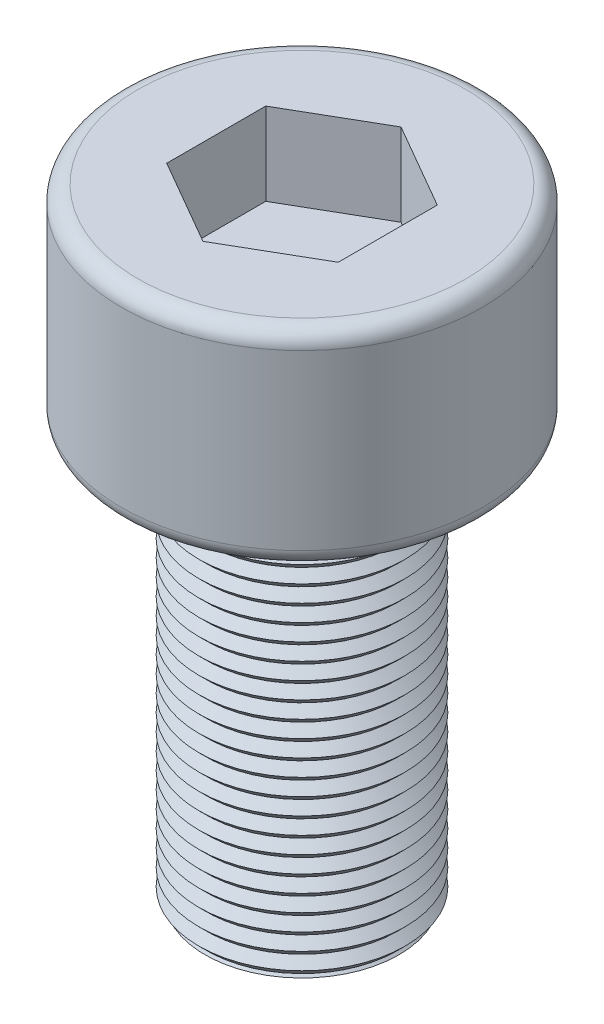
SolidWorks part; units mm, degrees
ref_plane "Front Plane" through (0, 0, 0) normal (0, 0, 1) x (1, 0, 0)
ref_plane "Top Plane" through (0, 0, 0) normal (0, 1, 0) x (1, 0, 0)
ref_plane "Right Plane" through (0, 0, 0) normal (1, 0, 0) x (0, 0, -1)
sketch "Sketch1" plane through (0, 0, 0) normal (0, 0, 1) x (1, 0, 0)
  line L0 (-1.4586, 6.35) -> (-1.5875, 6.35)
  line L1 (-2.7781, 6.35) -> (-2.7781, 9.525)
  line L2 (-2.7781, 9.525) -> (0, 9.525)
  line L3 (-1.4586, 6.35) -> (-1.5875, 6.35)
  line L4 (-1.5747, -3.175) -> (0, -3.175)
  line L5 (0, 0) -> (0, -3.175)
  line L6 (-1.5875, 0.1633) -> (-1.4586, 0.2922)
  line L7 (-1.4586, 0.2922) -> (-1.5875, 0.4211)
  line L8 (-1.5875, 0.4211) -> (-1.4586, 0.55)
  line L9 (-1.4586, 0.55) -> (-1.5875, 0.6789)
  line L10 (-1.5875, 0.6789) -> (-1.4586, 0.8078)
  line L11 (-1.4586, 0.8078) -> (-1.5875, 0.9367)
  line L12 (-1.5875, 0.9367) -> (-1.4586, 1.0655)
  line L13 (-1.4586, 1.0655) -> (-1.5875, 1.1944)
  line L14 (-1.5875, 1.1944) -> (-1.4586, 1.3233)
  line L15 (-1.4586, 1.3233) -> (-1.5875, 1.4522)
  line L16 (-1.5875, 1.4522) -> (-1.4586, 1.5811)
  line L17 (-1.4586, 1.5811) -> (-1.5875, 1.71)
  line L18 (-1.5875, 1.71) -> (-1.4586, 1.8389)
  line L19 (-1.4586, 1.8389) -> (-1.5875, 1.9678)
  line L20 (-1.5875, 1.9678) -> (-1.4586, 2.0967)
  line L21 (-1.4586, 2.0967) -> (-1.5875, 2.2255)
  line L22 (-1.5875, 2.2255) -> (-1.4586, 2.3544)
  line L23 (-1.4586, 2.3544) -> (-1.5875, 2.4833)
  line L24 (-1.5875, 2.4833) -> (-1.4586, 2.6122)
  line L25 (-1.4586, 2.6122) -> (-1.5875, 2.7411)
  line L26 (-1.5875, 2.7411) -> (-1.4586, 2.87)
  line L27 (-1.4586, 2.87) -> (-1.5875, 2.9989)
  line L28 (-1.5875, 2.9989) -> (-1.4586, 3.1278)
  line L29 (-1.4586, 3.1278) -> (-1.5875, 3.2567)
  line L30 (-1.5875, 3.2567) -> (-1.4586, 3.3855)
  line L31 (-1.4586, 3.3855) -> (-1.5875, 3.5144)
  line L32 (-1.5875, 3.5144) -> (-1.4586, 3.6433)
  line L33 (-1.4586, 3.6433) -> (-1.5875, 3.7722)
  line L34 (-1.5875, 3.7722) -> (-1.4586, 3.9011)
  line L35 (-1.4586, 3.9011) -> (-1.5875, 4.03)
  line L36 (-1.5875, 4.03) -> (-1.4586, 4.1589)
  line L37 (-1.4586, 4.1589) -> (-1.5875, 4.2878)
  line L38 (-1.5875, 4.2878) -> (-1.4586, 4.4167)
  line L39 (-1.4586, 4.4167) -> (-1.5875, 4.5455)
  line L40 (-1.5875, 4.5455) -> (-1.4586, 4.6744)
  line L41 (-1.4586, 4.6744) -> (-1.5875, 4.8033)
  line L42 (-1.5875, 4.8033) -> (-1.4586, 4.9322)
  line L43 (-1.4586, 4.9322) -> (-1.5875, 5.0611)
  line L44 (-1.5875, 5.0611) -> (-1.4586, 5.19)
  line L45 (-1.4586, 5.19) -> (-1.5875, 5.3189)
  line L46 (-1.5875, 5.3189) -> (-1.4586, 5.4478)
  line L47 (-1.4586, 5.4478) -> (-1.5875, 5.5767)
  line L48 (-1.5875, 5.5767) -> (-1.4586, 5.7055)
  line L49 (-1.5875, 6.0922) -> (-1.4586, 6.2211)
  line L50 (-1.4586, 6.2211) -> (-1.4586, 6.35)
  line L51 (-2.7781, 9.525) -> (0, 9.525)
  line L52 (-1.4586, 5.7055) -> (-1.5875, 5.8344)
  line L53 (-1.5875, 5.8344) -> (-1.4586, 5.9633)
  line L54 (-1.4586, 5.9633) -> (-1.5875, 6.0922)
  line L55 (-1.5875, 6.0922) -> (-1.4586, 6.2211)
  line L57 (0, 9.525) -> (0, 0)
  line L58 (-1.4586, 6.35) -> (-1.5875, 6.35)
  line L59 (-2.7781, 6.35) -> (-2.7781, 9.525)
  line L60 (-2.7781, 9.525) -> (0, 9.525)
  line L61 (-1.4586, 6.35) -> (-1.5875, 6.35)
  line L63 (-1.4586, 0.0344) -> (-1.5875, 0.1633)
  line L64 (-1.5875, 0.1633) -> (-1.4586, 0.2922)
  line L65 (-1.4586, 0.2922) -> (-1.5875, 0.4211)
  line L66 (-1.5875, 0.4211) -> (-1.4586, 0.55)
  line L67 (-1.4586, 0.55) -> (-1.5875, 0.6789)
  line L68 (-1.5875, 0.6789) -> (-1.4586, 0.8078)
  line L69 (-1.4586, 0.8078) -> (-1.5875, 0.9367)
  line L70 (-1.5875, 0.9367) -> (-1.4586, 1.0655)
  line L71 (-1.4586, 1.0655) -> (-1.5875, 1.1944)
  line L72 (-1.5875, 1.1944) -> (-1.4586, 1.3233)
  line L73 (-1.4586, 1.3233) -> (-1.5875, 1.4522)
  line L74 (-1.5875, 1.4522) -> (-1.4586, 1.5811)
  line L75 (-1.4586, 1.5811) -> (-1.5875, 1.71)
  line L76 (-1.5875, 1.71) -> (-1.4586, 1.8389)
  line L77 (-1.4586, 1.8389) -> (-1.5875, 1.9678)
  line L78 (-1.5875, 1.9678) -> (-1.4586, 2.0967)
  line L79 (-1.4586, 2.0967) -> (-1.5875, 2.2255)
  line L80 (-1.5875, 2.2255) -> (-1.4586, 2.3544)
  line L81 (-1.4586, 2.3544) -> (-1.5875, 2.4833)
  line L82 (-1.5875, 2.4833) -> (-1.4586, 2.6122)
  line L83 (-1.4586, 2.6122) -> (-1.5875, 2.7411)
  line L84 (-1.5875, 2.7411) -> (-1.4586, 2.87)
  line L85 (-1.4586, 2.87) -> (-1.5875, 2.9989)
  line L86 (-1.5875, 2.9989) -> (-1.4586, 3.1278)
  line L87 (-1.4586, 3.1278) -> (-1.5875, 3.2567)
  line L88 (-1.5875, 3.2567) -> (-1.4586, 3.3855)
  line L89 (-1.4586, 3.3855) -> (-1.5875, 3.5144)
  line L90 (-1.5875, 3.5144) -> (-1.4586, 3.6433)
  line L91 (-1.4586, 3.6433) -> (-1.5875, 3.7722)
  line L92 (-1.5875, 3.7722) -> (-1.4586, 3.9011)
  line L93 (-1.4586, 3.9011) -> (-1.5875, 4.03)
  line L94 (-1.5875, 4.03) -> (-1.4586, 4.1589)
  line L95 (-1.4586, 4.1589) -> (-1.5875, 4.2878)
  line L96 (-1.5875, 4.2878) -> (-1.4586, 4.4167)
  line L97 (-1.4586, 4.4167) -> (-1.5875, 4.5455)
  line L98 (-1.5875, 4.5455) -> (-1.4586, 4.6744)
  line L99 (-1.4586, 4.6744) -> (-1.5875, 4.8033)
  line L100 (-1.5875, 4.8033) -> (-1.4586, 4.9322)
  line L101 (-1.4586, 4.9322) -> (-1.5875, 5.0611)
  line L102 (-1.5875, 5.0611) -> (-1.4586, 5.19)
  line L103 (-1.4586, 5.19) -> (-1.5875, 5.3189)
  line L104 (-1.5875, 5.3189) -> (-1.4586, 5.4478)
  line L105 (-1.4586, 5.4478) -> (-1.5875, 5.5767)
  line L106 (-1.5875, 5.5767) -> (-1.4586, 5.7055)
  line L107 (-1.5875, 6.0922) -> (-1.4586, 6.2211)
  line L108 (-1.4586, 6.2211) -> (-1.4586, 6.35)
  line L109 (-2.7781, 9.525) -> (0, 9.525)
  line L110 (-1.4586, 5.7055) -> (-1.5875, 5.8344)
  line L111 (-1.5875, 5.8344) -> (-1.4586, 5.9633)
  line L112 (-1.4586, 5.9633) -> (-1.5875, 6.0922)
  line L113 (-1.5875, 6.0922) -> (-1.4586, 6.2211)
  line L115 (0, 9.525) -> (0, 0)
  line L116 (-1.5875, 6.35) -> (-2.7781, 6.35)
  line L117 (-2.7781, 6.35) -> (-2.7781, -3.175) construction
  line L130 (-1.5747, -3.175) -> (-1.4586, -3.0589)
  line L131 (-1.4586, -3.0589) -> (-1.5875, -2.93)
  line L132 (-1.5875, -2.93) -> (-1.4586, -2.8011)
  line L133 (-1.4586, -2.8011) -> (-1.5875, -2.6722)
  line L134 (-1.5875, -2.6722) -> (-1.4586, -2.5433)
  line L135 (-1.4586, -2.5433) -> (-1.5875, -2.4145)
  line L136 (-1.5875, -2.4145) -> (-1.4586, -2.2856)
  line L137 (-1.4586, -2.2856) -> (-1.5875, -2.1567)
  line L138 (-1.5875, -2.1567) -> (-1.4586, -2.0278)
  line L139 (-1.4586, -2.0278) -> (-1.5875, -1.8989)
  line L140 (-1.5875, -1.8989) -> (-1.4586, -1.77)
  line L141 (-1.4586, -1.77) -> (-1.5875, -1.6411)
  line L142 (-1.5875, -1.6411) -> (-1.4586, -1.5122)
  line L143 (-1.4586, -1.5122) -> (-1.5875, -1.3833)
  line L144 (-1.5875, -1.3833) -> (-1.4586, -1.2545)
  line L145 (-1.4586, -1.2545) -> (-1.5875, -1.1256)
  line L146 (-1.5875, -1.1256) -> (-1.4586, -0.9967)
  line L147 (-1.4586, -0.9967) -> (-1.5875, -0.8678)
  line L148 (-1.5875, -0.8678) -> (-1.4586, -0.7389)
  line L149 (-1.4586, -0.7389) -> (-1.5875, -0.61)
  line L150 (-1.5875, -0.61) -> (-1.4586, -0.4811)
  line L151 (-1.4586, -0.4811) -> (-1.5875, -0.3522)
  line L152 (-1.5875, -0.3522) -> (-1.4586, -0.2233)
  line L153 (-1.4586, -0.2233) -> (-1.5875, -0.0945)
  line L154 (-1.5875, -0.0945) -> (-1.4586, 0.0344)
  line L155 (-1.4586, 0.0344) -> (-1.5875, 0.1633)
  line L169 (-1.5747, -3.175) -> (-1.4586, -3.0589)
  line L170 (-1.4586, -3.0589) -> (-1.5875, -2.93)
  line L171 (-1.5875, -2.93) -> (-1.4586, -2.8011)
  line L172 (-1.4586, -2.8011) -> (-1.5875, -2.6722)
  line L173 (-1.5875, -2.6722) -> (-1.4586, -2.5433)
  line L174 (-1.4586, -2.5433) -> (-1.5875, -2.4145)
  line L175 (-1.5875, -2.4145) -> (-1.4586, -2.2856)
  line L176 (-1.4586, -2.2856) -> (-1.5875, -2.1567)
  line L177 (-1.5875, -2.1567) -> (-1.4586, -2.0278)
  line L178 (-1.4586, -2.0278) -> (-1.5875, -1.8989)
  line L179 (-1.5875, -1.8989) -> (-1.4586, -1.77)
  line L180 (-1.4586, -1.77) -> (-1.5875, -1.6411)
  line L181 (-1.5875, -1.6411) -> (-1.4586, -1.5122)
  line L182 (-1.4586, -1.5122) -> (-1.5875, -1.3833)
  line L183 (-1.5875, -1.3833) -> (-1.4586, -1.2545)
  line L184 (-1.4586, -1.2545) -> (-1.5875, -1.1256)
  line L185 (-1.5875, -1.1256) -> (-1.4586, -0.9967)
  line L186 (-1.4586, -0.9967) -> (-1.5875, -0.8678)
  line L187 (-1.5875, -0.8678) -> (-1.4586, -0.7389)
  line L188 (-1.4586, -0.7389) -> (-1.5875, -0.61)
  line L189 (-1.5875, -0.61) -> (-1.4586, -0.4811)
  line L190 (-1.4586, -0.4811) -> (-1.5875, -0.3522)
  line L191 (-1.5875, -0.3522) -> (-1.4586, -0.2233)
  line L192 (-1.4586, -0.2233) -> (-1.5875, -0.0945)
  line L193 (-1.5875, -0.0945) -> (-1.4586, 0.0344)
  line L194 (-1.4586, 0.0344) -> (-1.5875, 0.1633)
  dimension "D1" = 9.525
  dimension "D2" = 9.525
revolve "Revolve1" add sketch "Sketch1" angle 360 about L57
sketch "Sketch2" plane through (0, 9.525, 0) normal (0, 1, 0) x (1, 0, 0)
  line L1 (0, 1.524) -> (-1.3198, 0.762)
  line L2 (-1.3198, 0.762) -> (-1.3198, -0.762)
  line L3 (-1.3198, -0.762) -> (0, -1.524)
  line L4 (0, -1.524) -> (1.3198, -0.762)
  line L5 (1.3198, -0.762) -> (1.3198, 0.762)
  line L6 (1.3198, 0.762) -> (0, 1.524)
  circle A0 centre (0, 0) radius 1.3198 construction
  dimension "D1" = 3.048
extrude "Cut-Extrude1" cut sketch "Sketch2" against normal blind 1.27
fillet "Fillet1" radius 0.254 2 edges at (-2.7781, 6.35, 0) (-2.7781, 9.525, 0)
sketch "Sketch3" plane through (0, -3.175, 0) normal (0, -1, 0) x (1, 0, 0)
  circle A0 centre (0, 0) radius 2.9256
extrude "Cut-Extrude2" cut sketch "Sketch3" against normal blind 3.175
